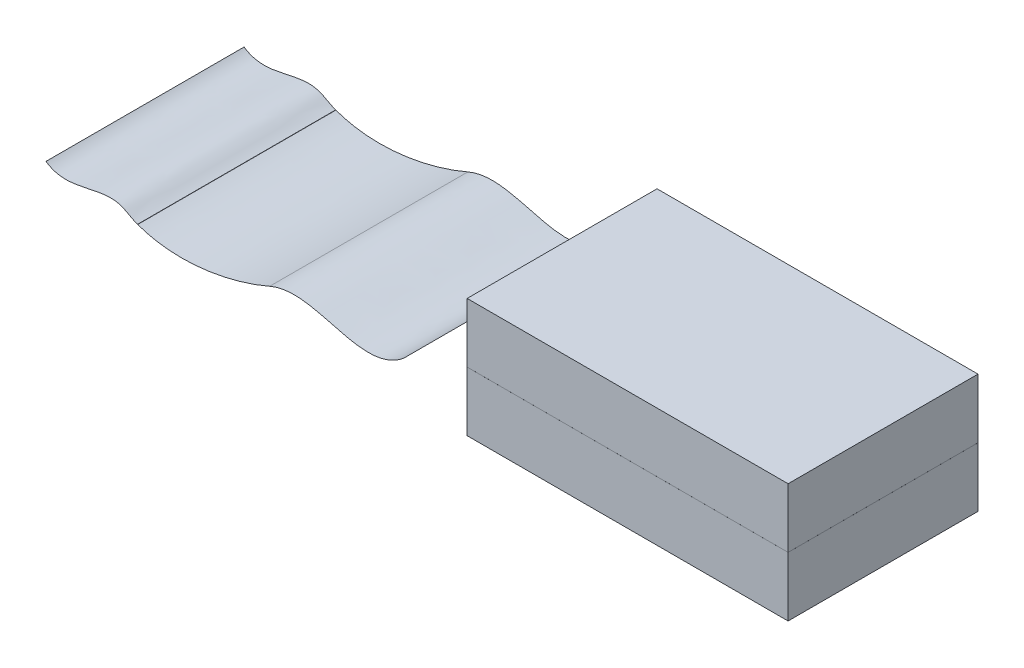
SolidWorks part; units mm, degrees
ref_plane "Front Plane" through (0, 0, 0) normal (0, 0, 1) x (1, 0, 0)
ref_plane "Top Plane" through (0, 0, 0) normal (0, 1, 0) x (1, 0, 0)
ref_plane "Right Plane" through (0, 0, 0) normal (1, 0, 0) x (0, 0, -1)
sketch "Sketch1" plane through (0, 0, 0) normal (0, 1, 0) x (1, 0, 0)
  line L1 (81.0033, -47.9269) -> (-81.0033, -47.9269)
  line L2 (81.0033, -47.9269) -> (81.0033, 47.9269)
  line L3 (81.0033, 47.9269) -> (-81.0033, 47.9269)
  line L4 (-81.0033, -47.9269) -> (-81.0033, 47.9269)
  line L5 (81.0033, -47.9269) -> (-81.0033, 47.9269) construction
  line L6 (81.0033, 47.9269) -> (-81.0033, -47.9269) construction
  point P0 (0, 0)
surface "Surface-Plane1" sketch "Sketch1"
sketch "Sketch2" plane through (0, 0, 0) normal (0, 1, 0) x (1, 0, 0)
  line L4 (-81.0033, 47.9269) -> (-81.0033, -47.9269)
  line L5 (-81.0033, -47.9269) -> (81.0033, -47.9269)
  line L6 (81.0033, -47.9269) -> (81.0033, 47.9269)
  line L7 (81.0033, 47.9269) -> (-81.0033, 47.9269)
  line L8 (-81.0033, 47.9269) -> (-81.0033, -47.9269)
  line L9 (-81.0033, -47.9269) -> (81.0033, -47.9269)
  line L10 (81.0033, -47.9269) -> (81.0033, 47.9269)
  line L11 (81.0033, 47.9269) -> (-81.0033, 47.9269)
  dimension "D1" = 0
surface "Surface-Extrude1" sketch "Sketch2" parameters "D1"=30
ref_plane "Plane1" through (0, 30.01, 0) normal (0, 1, 0) x (1, 0, 0)
sketch "Sketch3" plane through (0, 30.01, 0) normal (0, 1, 0) x (1, 0, 0)
  line L4 (-81.0033, 47.9269) -> (-81.0033, -47.9269)
  line L5 (-81.0033, -47.9269) -> (81.0033, -47.9269)
  line L6 (81.0033, -47.9269) -> (81.0033, 47.9269)
  line L7 (81.0033, 47.9269) -> (-81.0033, 47.9269)
  line L8 (-81.0033, 47.9269) -> (-81.0033, -47.9269)
  line L9 (-81.0033, -47.9269) -> (81.0033, -47.9269)
  line L10 (81.0033, -47.9269) -> (81.0033, 47.9269)
  line L11 (81.0033, 47.9269) -> (-81.0033, 47.9269)
  dimension "D1" = 0
surface "Surface-Extrude2" sketch "Sketch3" parameters "D1"=30
sketch "Sketch4" plane through (0, 0, 0) normal (0, 0, 1) x (1, 0, 0)
  spline S0 degree 3 poles (-178.5761, 17.5731) (-155.4848, 27.6867) (-132.4603, 2.3917) (-111.0504, 19.8268) knots 0 0 0 0 1 1 1 1
surface "Surface-Extrude3" sketch "Sketch4" parameters "D1"=100
sketch "Sketch5" plane through (0, 0, 0) normal (0, 0, 1) x (1, 0, 0)
  spline S0 degree 3 poles (-178.5761, 17.5731) (-197.4001, 9.3286) (-224.3463, 3.717) (-245.2006, 11.2691) knots 0 0 0 0 1 1 1 1
  spline S1 degree 3 poles (-111.0504, 19.8268) (-132.4603, 2.3917) (-155.4848, 27.6867) (-178.5761, 17.5731) knots 0 0 0 0 1 1 1 1 construction
surface "Surface-Extrude4" sketch "Sketch5" parameters "D1"=100
sketch "Sketch6" plane through (0, 0, 0) normal (0, 0, 1) x (1, 0, 0)
  line L0 (-245.2006, 11.2691) -> (-245.2946, 11.3032) construction
  spline S0 degree 3 poles (-245.2006, 11.2691) (-224.3463, 3.717) (-197.4001, 9.3286) (-178.5761, 17.5731) knots 0 0 0 0 1 1 1 1 construction
  spline S2 degree 3 poles (-245.2946, 11.3032) (-248.4147, 12.4331) (-260.9225, 21.9687) (-280.0304, 7.6234) (-291.4973, 15.7136) knots 0 0 0 0 0.187134 1 1 1 1
  dimension "D1" = 0.1
surface "Surface-Extrude5" sketch "Sketch6" parameters "D1"=100
